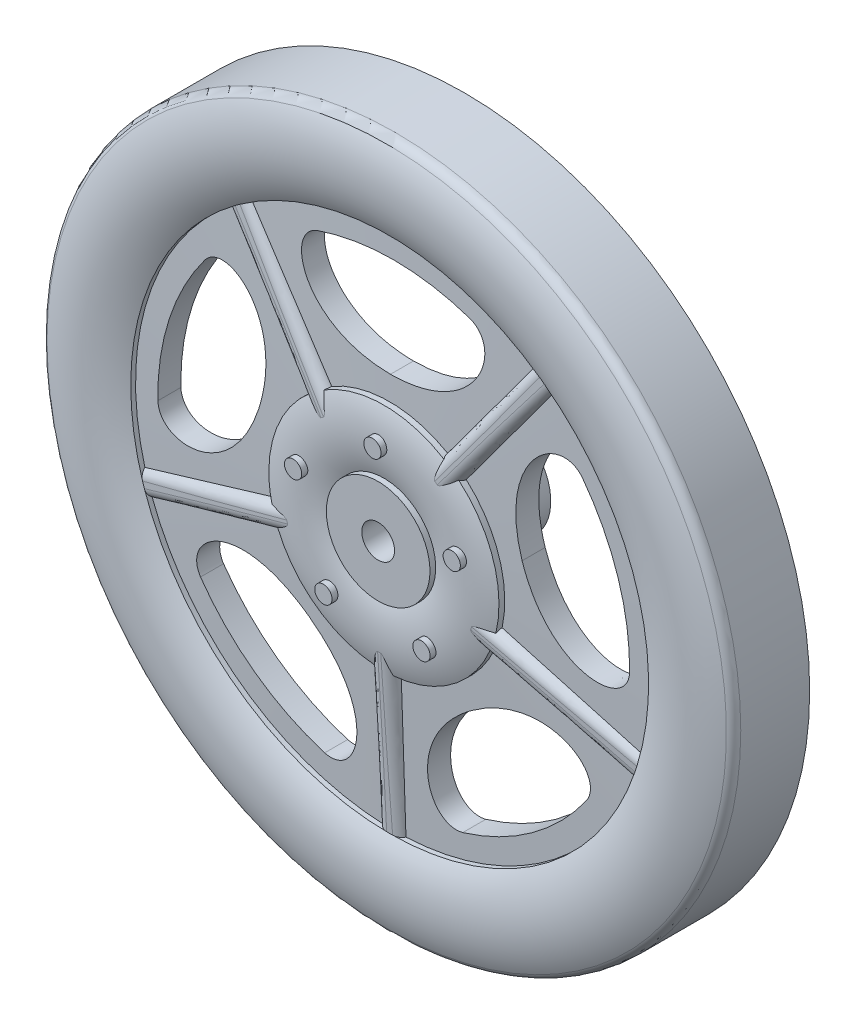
SolidWorks part; units mm, degrees
ref_plane "Plan de face" through (0, 0, 0) normal (0, 0, 1) x (1, 0, 0)
ref_plane "Plan de dessus" through (0, 0, 0) normal (0, 1, 0) x (1, 0, 0)
ref_plane "Plan de droite" through (0, 0, 0) normal (1, 0, 0) x (0, 0, -1)
sketch "Esquisse1" plane through (0, 0, 0) normal (0, 1, 0) x (1, 0, 0)
  line L0 (-9.5432, 0) -> (53.1323, 0) construction
  line L1 (0, 19.7061) -> (0, -20.2019) construction
  line L2 (30, 40.032) -> (30, -8.5517) construction
  line L3 (-12.8761, 10.5) -> (53.1323, 10.5) construction
  line L4 (1.425, 10.8829) -> (1.425, -18.494) construction
  line L5 (4.5, 10.8829) -> (4.5, -18.494) construction
  line L6 (3.1787, 0.5) -> (17.981, 0.5) construction
  line L7 (37.2638, 7.5) -> (65.4001, 7.5) construction
  line L8 (38.1037, 1) -> (66.135, 1) construction
  line L9 (22.5, 10.5) -> (22.5, -13.9545) construction
  line L10 (10, 3.3316) -> (10, -9.1026) construction
  line L11 (30, 7.5) -> (30, 1)
  line L12 (35.6933, 1.4167) -> (45.6989, 1.4167) construction
  line L13 (22.5, 1) -> (22.5, 1.4167)
  line L14 (3.1787, 1) -> (16.0713, 1) construction
  line L15 (10, 0.5) -> (10, 1)
  line L16 (10, 1) -> (22.5, 1.4167)
  line L17 (4.5, 0.5) -> (4.5, 0)
  line L18 (4.5, 0) -> (1.425, 0)
  line L19 (8, 2.0486) -> (8, 2.9344)
  line L20 (8, 2.9344) -> (24.5, 3.4844)
  line L21 (24.5, 2.2841) -> (24.5, 3.4844)
  line L22 (28, 7.5) -> (28, 2.2841)
  line L23 (2.5, 4.4626) -> (2.5, 0) construction
  line L24 (1.425, 0) -> (1.425, 10.5)
  line L25 (1.425, 10.5) -> (4.5, 10.5)
  line L26 (4.5, 10.5) -> (4.5, 2.6917)
  line L27 (28, 7.5) -> (30, 7.5)
  arc A0 (22.5, 1) -> (30, 1) centre (26.25, 7.5313) ccw
  arc A1 (4.5, 0.5) -> (10, 0.5) centre (7.25, 7.8124) ccw
  arc A2 (4.5, 2.6917) -> (8, 2.0486) centre (7.25, 7.8124) ccw
  arc A3 (24.5, 2.2841) -> (28, 2.2841) centre (26.25, 7.5313) ccw
  arc A4 (2.5, 4.4626) -> (8, 2.0486) centre (7.25, 7.8124) ccw construction
  dimension "D1" = 2
revolve "Révolution1" add sketch "Esquisse1" angle 360 about L1
sketch "Esquisse2" plane through (0, 0, 0) normal (0, 0, 1) x (1, 0, 0)
  line L0 (0, 0) -> (70.2258, 0) construction
  line L1 (70.2258, 0) -> (0, 0) construction
  line L2 (0, 0) -> (37.7738, 51.9912) construction
  line L3 (0, 0) -> (-43.3396, 59.6518) construction
  line L4 (-4.8541, 3.5267) -> (32.9197, 55.5179) construction
  line L5 (4.8541, 3.5267) -> (-38.4855, 63.1786) construction
  line L6 (0, 0) -> (0, 53.8968) construction
  line L7 (-10.907, 12.0301) -> (26.5978, 12.0301) construction
  arc A4 (6.6678, 19.3853) -> (-6.6678, 19.3853) centre (0, 0) ccw
  arc A5 (-16.376, 12.3319) -> (-20.497, -0.3511) centre (0, 0) ccw
  arc A6 (-16.7888, -11.7638) -> (-6, -19.6023) centre (0, 0) ccw
  arc A7 (6, -19.6023) -> (16.7888, -11.7638) centre (0, 0) ccw
  arc A8 (20.497, -0.3511) -> (16.376, 12.3319) centre (0, 0) ccw
  spline S8 degree 3 poles (-6.6678, 19.3853) (-9.5908, 18.2333) (-7.647, 12.0685) (0, 12.0301) knots 0 0 0 0 1 1 1 1
  spline S9 degree 3 poles (6.6678, 19.3853) (9.5908, 18.2333) (7.647, 12.0685) (0, 12.0301) knots 0 0 0 0 1 1 1 1
  spline S10 degree 3 poles (-20.497, -0.3511) (-20.3046, -3.487) (-13.8409, -3.5433) (-11.4413, 3.7175) knots 0 0 0 0 1 1 1 1
  spline S11 degree 3 poles (-16.376, 12.3319) (-14.3772, 14.7558) (-9.1148, 11.0021) (-11.4413, 3.7175) knots 0 0 0 0 1 1 1 1
  spline S12 degree 3 poles (-6, -19.6023) (-2.9582, -20.3884) (-0.9071, -14.2584) (-7.0711, -9.7326) knots 0 0 0 0 1 1 1 1
  spline S13 degree 3 poles (-16.7888, -11.7638) (-18.4764, -9.1137) (-13.2802, -5.2688) (-7.0711, -9.7326) knots 0 0 0 0 1 1 1 1
  spline S14 degree 3 poles (16.7888, -11.7638) (18.4764, -9.1137) (13.2802, -5.2688) (7.0711, -9.7326) knots 0 0 0 0 1 1 1 1
  spline S15 degree 3 poles (6, -19.6023) (2.9582, -20.3884) (0.9071, -14.2584) (7.0711, -9.7326) knots 0 0 0 0 1 1 1 1
  spline S16 degree 3 poles (16.376, 12.3319) (14.3772, 14.7558) (9.1148, 11.0021) (11.4413, 3.7175) knots 0 0 0 0 1 1 1 1
  spline S17 degree 3 poles (20.497, -0.3511) (20.3046, -3.487) (13.8409, -3.5433) (11.4413, 3.7175) knots 0 0 0 0 1 1 1 1
  dimension "D1" = 54
  dimension "D2" = 54
  dimension "D4" = 6
extrude "Enlèv. mat.-Extru.1" cut sketch "Esquisse2" against normal through all
sketch "Esquisse3" plane through (0, 0, 0) normal (0, 0, 1) x (1, 0, 0)
  circle A0 centre (0, 0) radius 7.25 construction
  circle A1 centre (0, 7.25) radius 0.75
  circle A2 centre (-6.8952, 2.2404) radius 0.75
  circle A3 centre (-4.2614, -5.8654) radius 0.75
  circle A4 centre (4.2614, -5.8654) radius 0.75
  circle A5 centre (6.8952, 2.2404) radius 0.75
extrude "Extrusion1" add sketch "Esquisse3" along normal mid plane 1
sketch "Esquisse5" plane through (0, 0, 0) normal (1, 0, 0) x (0, 0, -1)
  line L0 (1, -8.1747) -> (1.4167, -18.5906) construction
  line L1 (1, 10) -> (1, -10) construction
  line L2 (1.4167, -22.5) -> (1.4167, 22.5) construction
  line L3 (0.0714, -8.1747) -> (1.0002, -22.5011)
  line L4 (1.0002, -22.5011) -> (1.4992, -22.641)
  line L5 (1.4992, -22.641) -> (1, -8.1747)
  line L6 (1, -8.1747) -> (0.0714, -8.1747)
extrude "Extrusion2" add sketch "Esquisse5" along normal mid plane 2
fillet "Congé variable2" radius 0.866 14 edges at (-1, -22.4778, -1.2083) (1, -22.4778, -1.2083) (0, -22.5, -1.0001) (-0.5545, -8.3778, -0.0845) (-1, -15.3914, -0.5393) (1, -9.9499, -0.75) (1, 10.485, -14.9017) (1, -15.3914, -0.5393) (-1, -9.9499, -0.75) (-1, 10.485, -14.9017)
pattern_circular "Répétition circulaire1" count 5 every 72 about axis through (0, 0, -19.7061) along (0, 0, 1) of "Extrusion2", "Congé variable2"
fillet "Congé1" radius 0.85 1 edges at (-30, 0, -1)
